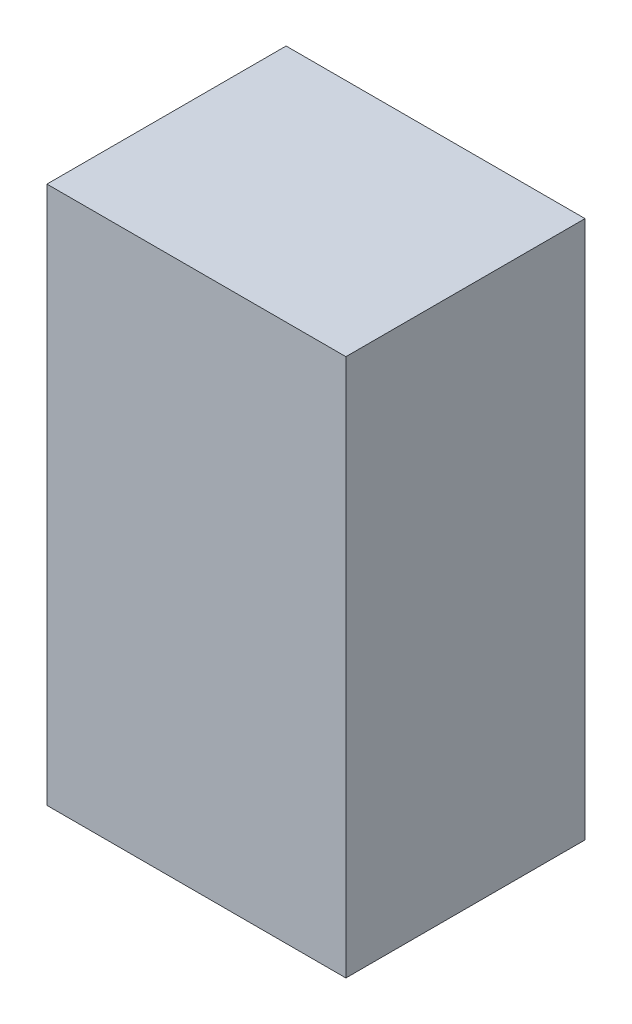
SolidWorks part; units mm, degrees
ref_plane "Ebene vorne" through (0, 0, 0) normal (0, 0, 1) x (1, 0, 0)
ref_plane "Ebene oben" through (0, 0, 0) normal (0, 1, 0) x (1, 0, 0)
ref_plane "Ebene rechts" through (0, 0, 0) normal (1, 0, 0) x (0, 0, -1)
sketch "Skizze1" plane through (0, 0, 0) normal (0, 0, 1) x (1, 0, 0)
  line L1 (0, 0) -> (25, 0)
  line L2 (0, 0) -> (0, -45)
  line L3 (0, -45) -> (25, -45)
  line L4 (25, 0) -> (25, -45)
  dimension "D1" = 25
  dimension "D2" = 45
extrude "Linear austragen1" add sketch "Skizze1" along normal blind 20
sketch "Skizze2"
  line L0 (-25, 0) -> (0, 20) construction
  line L1 (-25, 20) -> (0, 20) construction
  line L3 (-25, 20) -> (0, 0) construction
